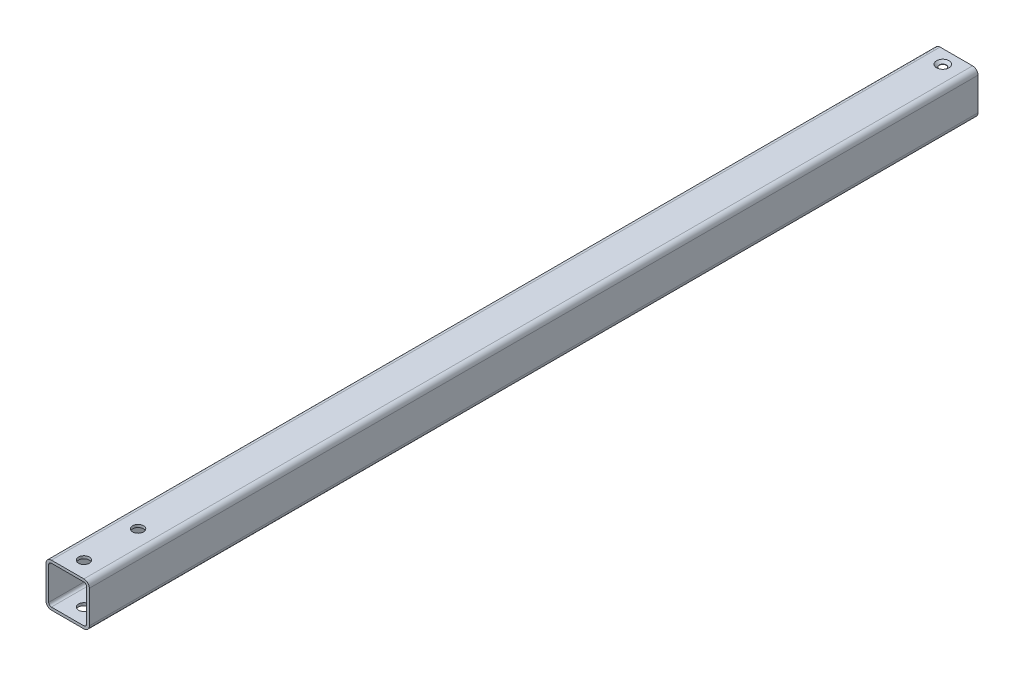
SolidWorks part; units mm, degrees
ref_plane "Front Plane" through (0, 0, 0) normal (0, 0, 1) x (1, 0, 0)
ref_plane "Top Plane" through (0, 0, 0) normal (0, 1, 0) x (1, 0, 0)
ref_plane "Right Plane" through (0, 0, 0) normal (1, 0, 0) x (0, 0, -1)
sketch "Sketch1" plane through (0, 0, 0) normal (0, 0, 1) x (1, 0, 0)
  line L1 (12.7, 12.7) -> (-12.7, 12.7)
  line L2 (12.7, 12.7) -> (12.7, -12.7)
  line L3 (12.7, -12.7) -> (-12.7, -12.7)
  line L4 (-12.7, 12.7) -> (-12.7, -12.7)
  line L5 (12.7, 12.7) -> (-12.7, -12.7) construction
  line L6 (12.7, -12.7) -> (-12.7, 12.7) construction
  point P0 (0, 0)
  dimension "D1" = 25.4
  dimension "D2" = 25.4
extrude "Extrude-Thin1" add sketch "Sketch1" along normal blind 520.7 thin
fillet "Fillet1" radius 3.175 4 edges at (-12.7, 12.7, 260.35) (-12.7, -12.7, 260.35) (12.7, -12.7, 260.35) (12.7, 12.7, 260.35)
fillet "Fillet2" radius 1.5748 4 edges at (-11.1252, -11.1252, 260.35) (11.1252, -11.1252, 260.35) (11.1252, 11.1252, 260.35) (-11.1252, 11.1252, 260.35)
sketch "Sketch2" plane through (0, 0, 0) normal (0, 1, 0) x (1, 0, 0)
  circle A0 centre (0, -7.9248) radius 2.0574
  dimension "D2" = 4.1148
  dimension "D1" = 7.9248
extrude "Cut-Extrude1" cut sketch "Sketch2" along normal blind 25.4
chamfer "Chamfer1" distance 1.5748 angle 41 1 edges at (2.0574, 12.7, 7.9248)
sketch "Sketch3" plane through (0, 0, 0) normal (0, 1, 0) x (1, 0, 0)
  line L0 (9.525, -520.7) -> (-9.525, -520.7) construction
  circle A0 centre (0, -511.175) radius 3.175
  circle A1 centre (0, -479.425) radius 3.175
  dimension "D1" = 6.35
  dimension "D2" = 9.525
  dimension "D3" = 31.75
extrude "Cut-Extrude2" cut sketch "Sketch3" against normal mid plane 50.8
